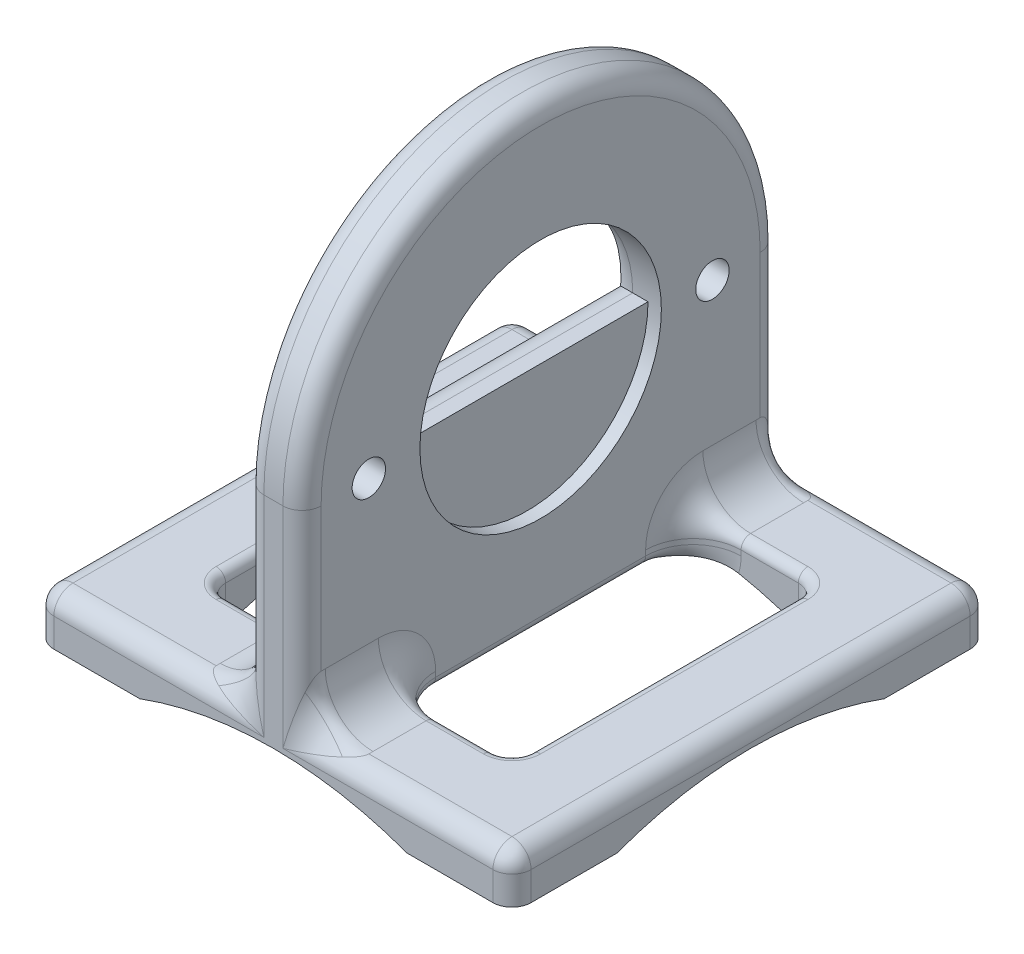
SolidWorks part; units mm, degrees
ref_plane "Front Plane" through (0, 0, 0) normal (0, 0, 1) x (1, 0, 0)
ref_plane "Top Plane" through (0, 0, 0) normal (0, 1, 0) x (1, 0, 0)
ref_plane "Right Plane" through (0, 0, 0) normal (1, 0, 0) x (0, 0, -1)
sketch "Sketch1" plane through (0, 0, 0) normal (0, 1, 0) x (1, 0, 0)
  line L1 (-23, -25) -> (23, -25)
  line L2 (-25, -23) -> (-25, 23)
  line L3 (-23, 25) -> (23, 25)
  line L4 (25, -23) -> (25, 23)
  line L5 (-25, -25) -> (25, 25) construction
  line L6 (-25, 25) -> (25, -25) construction
  line L7 (14, 16) -> (-14, 16)
  line L8 (16, 14) -> (16, -14)
  line L9 (14, -16) -> (-14, -16)
  line L10 (-16, 14) -> (-16, -14)
  line L11 (16, 16) -> (-16, -16) construction
  line L12 (16, -16) -> (-16, 16) construction
  arc A0 (-23, -25) -> (-25, -23) centre (-23, -23) cw
  arc A1 (23, -25) -> (25, -23) centre (23, -23) ccw
  arc A2 (23, 25) -> (25, 23) centre (23, 23) cw
  arc A3 (-25, 23) -> (-23, 25) centre (-23, 23) cw
  circle A4 centre (-20, 20) radius 2.55
  circle A5 centre (20, 20) radius 2.55
  circle A6 centre (20, -20) radius 2.55
  circle A7 centre (-20, -20) radius 2.55
  arc A8 (14, 16) -> (16, 14) centre (14, 14) cw
  arc A9 (16, -14) -> (14, -16) centre (14, -14) cw
  arc A10 (-14, -16) -> (-16, -14) centre (-14, -14) cw
  arc A11 (-14, 16) -> (-16, 14) centre (-14, 14) ccw
  point P0 (0, 0)
  point P26 (0, 0)
  dimension "D3" = 2
  dimension "D8" = 5.1
  dimension "D11" = 2
  dimension "D1" = 50
  dimension "D2" = 50
  dimension "D4" = 5
  dimension "D5" = 5
  dimension "D6" = 5
  dimension "D7" = 5
  dimension "D9" = 32
  dimension "D10" = 32
extrude "Boss-Extrude1" add sketch "Sketch1" along normal blind 5
sketch "Sketch3" plane through (0, 5, 0) normal (0, 1, 0) x (1, 0, 0)
  circle A0 centre (-20, 20) radius 3
  circle A1 centre (20, 20) radius 3
  circle A2 centre (20, -20) radius 3
  circle A3 centre (-20, -20) radius 3
  dimension "D1" = 6
extrude "Boss-Extrude3" add sketch "Sketch3" against normal blind 1.5
sketch "Sketch4" plane through (0, 5, 0) normal (0, 1, 0) x (1, 0, 0)
  line L1 (3, -25) -> (-3, -25)
  line L2 (3, -25) -> (3, 25)
  line L3 (3, 25) -> (-3, 25)
  line L4 (-3, -25) -> (-3, 25)
  line L5 (3, -25) -> (-3, 25) construction
  line L6 (3, 25) -> (-3, -25) construction
  line L7 (-23, -25) -> (23, -25) construction
  point P0 (0, 0)
  dimension "D1" = 6
extrude "Boss-Extrude4" add sketch "Sketch4" against normal up to surface (5 mm away)
sketch "Sketch5" plane through (0, 5, 0) normal (0, 1, 0) x (1, 0, 0)
  line L0 (3, -16) -> (3, 16) construction
  line L1 (-3, -25) -> (3, -25)
  line L2 (-3, -25) -> (-3, 25)
  line L3 (-3, 25) -> (3, 25)
  line L4 (3, -25) -> (3, 25)
  line L5 (-3, -25) -> (3, 25) construction
  line L6 (-3, 25) -> (3, -25) construction
  line L7 (-23, -25) -> (23, -25) construction
  point P0 (0, 0)
extrude "Boss-Extrude5" add sketch "Sketch5" along normal blind 20
sketch "Sketch6" plane through (3, 0, 0) normal (1, 0, 0) x (0, 0, -1)
  line L0 (-25, 25) -> (25, 25) construction
  line L1 (-25, 25) -> (-12.65, 25)
  line L2 (12.65, 25) -> (25, 25)
  arc A0 (12.65, 25) -> (-12.65, 25) centre (0, 25) ccw
  arc A1 (25, 25) -> (-25, 25) centre (0, 25) ccw
  dimension "D1" = 25.3
extrude "Boss-Extrude6" add sketch "Sketch6" against normal up to surface (6 mm away)
sketch "Sketch7" plane through (3, 0, 0) normal (1, 0, 0) x (0, 0, -1)
  line L0 (-12.65, 25) -> (12.65, 25) construction
  circle A0 centre (0, 25) radius 12.65
  dimension "D1" = 25.3
extrude "Cut-Extrude1" cut sketch "Sketch7" against normal blind 1.4
sketch "Sketch8" plane through (0, 0, 25) normal (0, 0, 1) x (1, 0, 0)
  line L0 (3, 5) -> (23, 5) construction
  line L1 (-14, 0) -> (14, 0)
  arc A0 (-14, 0) -> (14, 0) centre (0, -37.95) cw
  point P3 (0, 2.5)
  dimension "D1" = 2.5
extrude "Cut-Extrude2" cut sketch "Sketch8" against normal through all
fillet "Fillet1" radius 2 16 edges at (13, 5, -25) (24.4142, 5, -24.4142) (25, 5, 0) (24.4142, 5, 24.4142) (-13, 5, -25) (-24.4142, 5, -24.4142) (-25, 5, 0) (-24.4142, 5, 24.4142) (-3, 15, -25) (-3, 15, 25) (3, 15, -25) (-3, 50, 0) (3, 50, 0) (13, 5, 25) (-13, 5, 25) (3, 15, 25)
fillet "Fillet3" radius 1 12 edges at (-8.5, 5, -16) (-15.4142, 5, -15.4142) (-8.5, 5, 16) (-15.4142, 5, 15.4142) (8.5, 5, -16) (15.4142, 5, -15.4142) (16, 5, 0) (15.4142, 5, 15.4142) (-3, 2.3886, 0) (3, 2.3886, 0) (-16, 5, 0) (8.5, 5, 16)
sketch "Sketch9" plane through (25, 0, 0) normal (1, 0, 0) x (0, 0, -1)
  line L0 (-23, 5) -> (23, 5) construction
  line L1 (-14, 0) -> (14, 0)
  arc A0 (-14, 0) -> (14, 0) centre (0, -37.95) cw
  point P7 (0, 2.5)
  dimension "D1" = 2.5
extrude "Cut-Extrude3" cut sketch "Sketch9" against normal through all
fillet "Fillet4" radius 5 20 edges at (2.6898, 2.7278, -16) (3, 3.7259, -16) (3, 4.7071, -16.2929) (2.4142, 4.4142, -24.4142) (-2.4142, 4.4142, -24.4142) (-2.6898, 2.7278, -16) (-3, 3.7259, -16) (-3, 4.7071, -16.2929) (-2.6898, 2.7278, 16) (-3, 3.7259, 16) (-3, 4.7071, 16.2929) (-2.4142, 4.4142, 24.4142) (2.4142, 4.4142, 24.4142) (2.6898, 2.7278, 16) (3, 3.7259, 16) (3, 4.7071, 16.2929) (3, 5, -20) (-3, 5, -20) (-3, 5, 20) (3, 5, 20)
sketch "Sketch10" plane through (3, 0, 0) normal (1, 0, 0) x (0, 0, -1)
  line L0 (18, 25) -> (-18, 25) construction
  line L2 (25, 25) -> (23, 25) construction
  circle A0 centre (-18, 25) radius 1.75
  circle A1 centre (18, 25) radius 1.75
  point P3 (0, 25)
  dimension "D2" = 3.5
  dimension "D1" = 36
extrude "Cut-Extrude4" cut sketch "Sketch10" against normal through all
fillet "Fillet5" radius 3 2 edges at (-3, 37.65, 0) (-3, 25, 0)
